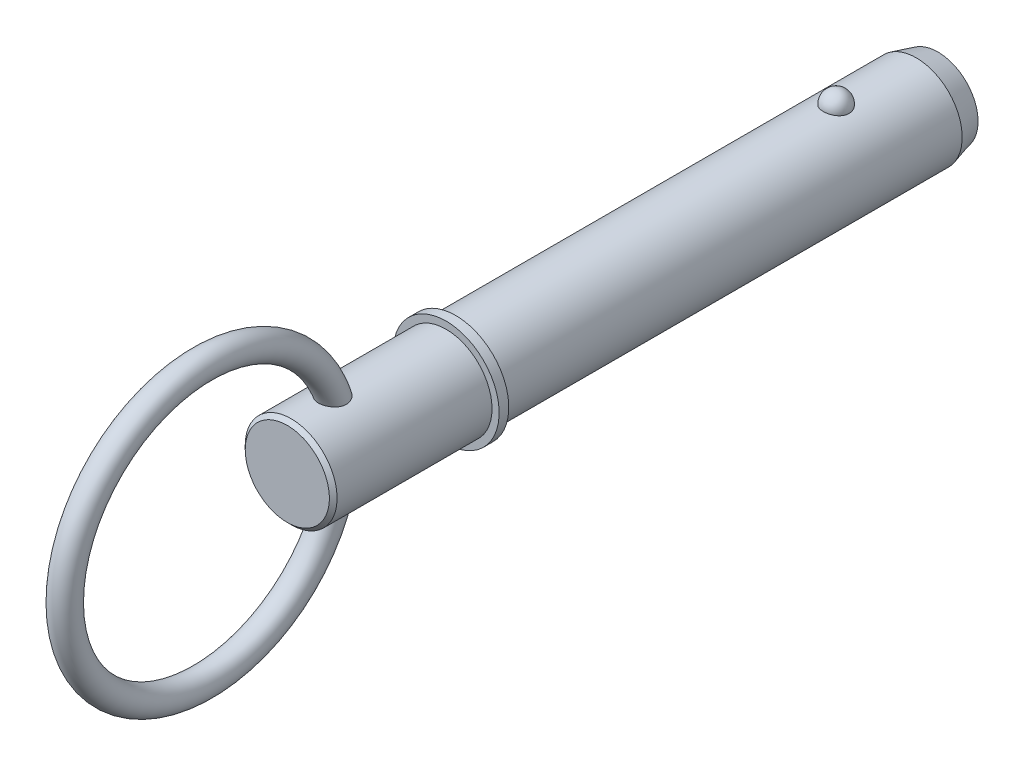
SolidWorks part; units mm, degrees
ref_plane "Front Plane" through (0, 0, 0) normal (0, 0, 1) x (1, 0, 0)
ref_plane "Top Plane" through (0, 0, 0) normal (0, 1, 0) x (1, 0, 0)
ref_plane "Right Plane" through (0, 0, 0) normal (1, 0, 0) x (0, 0, -1)
sketch "Sketch2" plane through (0, 0, 0) normal (0, 0, 1) x (1, 0, 0)
  circle A0 centre (0, 0) radius 9.525
  point P3 (0, 9.525)
  dimension "D1" = 19.05
extrude "Boss-Extrude1" add sketch "Sketch2" along normal blind 76.2
sketch "Sketch3" plane through (0, 0, 0) normal (0, 0, -1) x (-1, 0, 0)
  circle A0 centre (0, 0) radius 9.525
  dimension "D1" = 19.05
extrude "Boss-Extrude2" add sketch "Sketch3" along normal blind 23.8
chamfer "Chamfer1" distance 4.5 angle 15 1 edges at (-9.525, 0, -23.8)
sketch "Sketch18" plane through (0, 0, 0) normal (1, 0, 0) x (0, 0, -1)
  line L0 (19.3, 9.525) -> (-76.2, 9.525) construction
  line L1 (2.69, 12.215) -> (2.69, 6.835)
  line L2 (-76.2, -9.525) -> (19.3, -9.525) construction
  arc A0 (2.69, 12.215) -> (2.69, 6.835) centre (2.69, 9.525) ccw
  point P4 (0, 9.525)
  dimension "D1" = 21.74
revolve "Revolve1" add sketch "Sketch18" angle 360 about L1
sketch "Sketch19" plane through (0, 0, 0) normal (1, 0, 0) x (0, 0, -1)
  line L0 (-33.7288, 0) -> (-46.4542, 0) construction
sketch "Sketch20" plane through (0, 0, 0) normal (1, 0, 0) x (0, 0, -1)
  line L0 (-76.2, 0) -> (-76.2, 11)
  line L1 (-76.2, 9.525) -> (-76.2, -9.525) construction
  line L2 (-76.2, 11) -> (-78.2, 11)
  line L3 (-78.2, 11) -> (-78.2, 0)
  line L4 (-33.7288, 0) -> (-46.4542, 0) construction
  line L5 (-78.2, 0) -> (-76.2, 0)
  dimension "D1" = 11
  dimension "D2" = 2
revolve "Revolve2" add sketch "Sketch20" angle 360 about L0
sketch "Sketch21" plane through (0, 0, 76.2) normal (0, 0, -1) x (-1, 0, 0)
  circle A0 centre (0, 0) radius 9.525
  dimension "D1" = 19.05
extrude "Boss-Extrude3" add sketch "Sketch21" against normal blind 34.93
chamfer "Chamfer2" distance 0.8 angle 45 1 edges at (-9.525, 0, 111.13)
sketch "Sketch23" plane through (0, 0, 0) normal (1, 0, 0) x (0, 0, -1)
  line L0 (-111.13, 8.725) -> (-111.13, -8.725) construction
  circle A0 centre (-128.705, 0) radius 28.575
  point P2 (-100.13, 0)
  dimension "D1" = 57.15
  dimension "D2" = 11
sketch "Sketch24" plane through (0, 0, 0) normal (0, 1, 0) x (1, 0, 0)
  circle A0 centre (0, -100.13) radius 2.75
  dimension "D1" = 5.5
sweep "Sweep1" add profiles "Sketch24" path "Sketch23"
